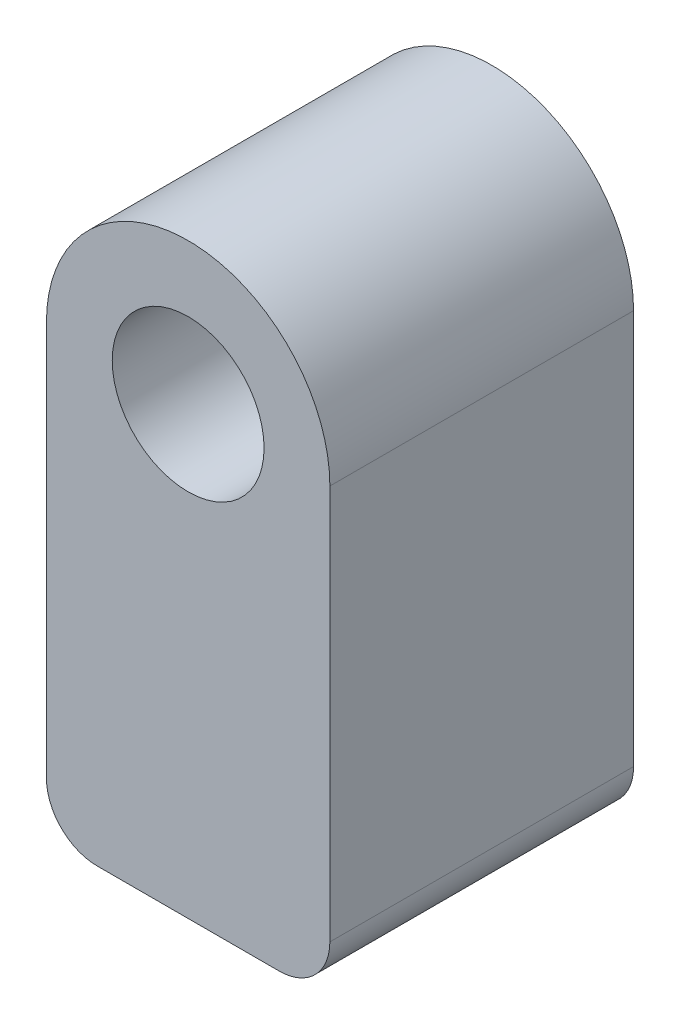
SolidWorks part; units mm, degrees
ref_plane "Front Plane" through (0, 0, 0) normal (0, 0, 1) x (1, 0, 0)
ref_plane "Top Plane" through (0, 0, 0) normal (0, 1, 0) x (1, 0, 0)
ref_plane "Right Plane" through (0, 0, 0) normal (1, 0, 0) x (0, 0, -1)
sketch "Sketch1" plane through (0, 0, 0) normal (0, 0, 1) x (1, 0, 0)
  line L0 (-381, -120.65) -> (-381, -158.75) construction
  line L1 (-363.22, -120.65) -> (-363.22, -158.75)
  line L2 (-398.78, -120.65) -> (-398.78, -158.75)
  line L4 (-398.78, -158.75) -> (-363.22, -158.75)
  line L5 (-398.78, -158.75) -> (-398.78, -176.53)
  line L6 (-398.78, -176.53) -> (-363.22, -176.53)
  line L7 (-363.22, -158.75) -> (-363.22, -176.53)
  line L8 (-398.78, -158.75) -> (-363.22, -176.53) construction
  line L9 (-398.78, -176.53) -> (-363.22, -158.75) construction
  arc A1 (-363.22, -120.65) -> (-398.78, -120.65) centre (-381, -120.65) ccw
  arc A2 (-398.78, -158.75) -> (-363.22, -158.75) centre (-381, -158.75) ccw
  circle A4 centre (-381, -120.65) radius 9.525
  point P0 (-381, -139.7)
  point P14 (-381, -167.64)
  dimension "D1" = 17.78
  dimension "D3" = 19.05
  dimension "D2" = 38.1
extrude "Boss-Extrude1" add sketch "Sketch1" along normal blind 38.1 contours A2 L5 L6 | A2 L6 L7 | L4 A2 | L1 A1 L2 L4 A4
fillet "Fillet1" radius 6.35 2 edges at (-363.22, -176.53, 19.05) (-398.78, -176.53, 19.05)
